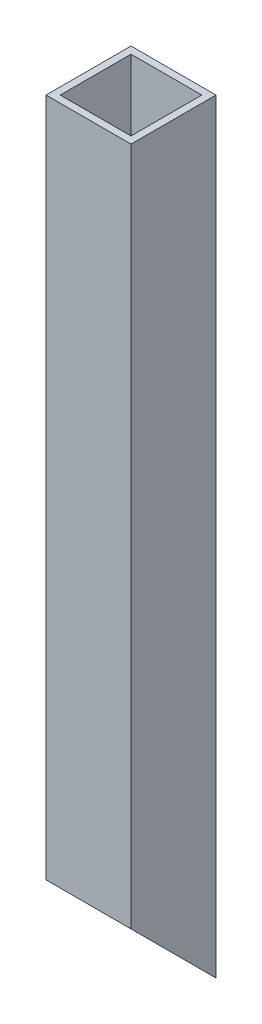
SolidWorks part; units mm, degrees
ref_plane "Front Plane" through (0, 0, 0) normal (0, 0, 1) x (1, 0, 0)
ref_plane "Top Plane" through (0, 0, 0) normal (0, 1, 0) x (1, 0, 0)
ref_plane "Right Plane" through (0, 0, 0) normal (1, 0, 0) x (0, 0, -1)
sketch "Sketch1" plane through (0, 0, 0) normal (0, 1, 0) x (1, 0, 0)
  line L1 (-19.05, 19.05) -> (19.05, 19.05)
  line L2 (-19.05, 19.05) -> (-19.05, -19.05)
  line L3 (-19.05, -19.05) -> (19.05, -19.05)
  line L4 (19.05, 19.05) -> (19.05, -19.05)
  line L5 (-15.875, 15.875) -> (15.875, 15.875)
  line L6 (-15.875, 15.875) -> (-15.875, -15.875)
  line L7 (-15.875, -15.875) -> (15.875, -15.875)
  line L8 (15.875, 15.875) -> (15.875, -15.875)
  dimension "D1" = 19.05
  dimension "D2" = 19.05
  dimension "D3" = 38.1
  dimension "D4" = 38.1
  dimension "D5" = 3.175
  dimension "D6" = 3.175
  dimension "D7" = 3.175
  dimension "D8" = 3.175
extrude "Boss-Extrude1" add sketch "Sketch1" along normal blind 304.8 contours L6 L7 L8 L5 | L2 L3 L4 L1
sketch "Sketch5" plane through (19.05, 0, 0) normal (1, 0, 0) x (0, 0, -1)
  line L0 (19.05, 0) -> (19.05, -38.1)
  line L1 (19.05, -38.1) -> (-19.05, 0)
  line L2 (19.05, 0) -> (-19.05, 0) construction
  line L3 (19.05, 0) -> (-19.05, 0)
  dimension "D1" = 45
extrude "Boss-Extrude2" add sketch "Sketch5" against normal up to surface (38.1 mm away)
sketch "Sketch6" plane through (0, 0, 0) normal (0, 1, 0) x (1, 0, 0)
  line L4 (15.875, 15.875) -> (-15.875, 15.875)
  line L5 (-15.875, 15.875) -> (-15.875, -15.875)
  line L6 (-15.875, -15.875) -> (15.875, -15.875)
  line L7 (15.875, -15.875) -> (15.875, 15.875)
  line L8 (15.875, 15.875) -> (-15.875, 15.875)
  line L9 (-15.875, 15.875) -> (-15.875, -15.875)
  line L10 (-15.875, -15.875) -> (15.875, -15.875)
  line L11 (15.875, -15.875) -> (15.875, 15.875)
  dimension "D1" = 0
extrude "Cut-Extrude1" cut sketch "Sketch6" against normal through all
